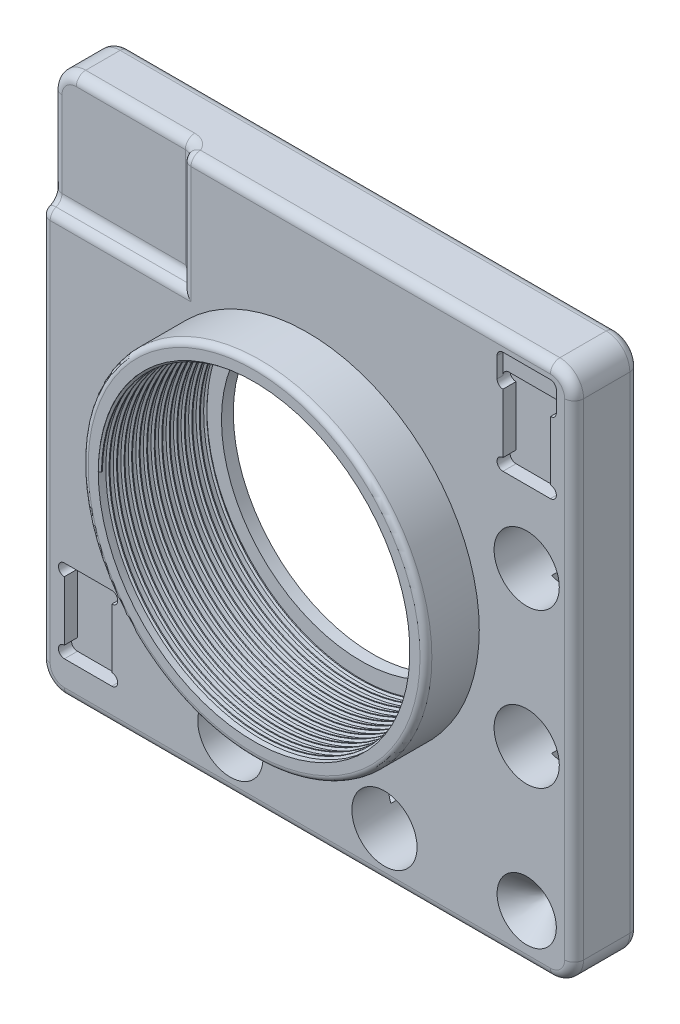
SolidWorks part; units mm, degrees
ref_plane "前视基准面" through (0, 0, 0) normal (0, 0, 1) x (1, 0, 0)
ref_plane "上视基准面" through (0, 0, 0) normal (0, 1, 0) x (1, 0, 0)
ref_plane "右视基准面" through (0, 0, 0) normal (1, 0, 0) x (0, 0, -1)
other "Configuration Table"
sketch "草图1" plane through (0, 0, 0) normal (0, 0, 1) x (1, 0, 0)
  line L1 (-22.5, 22.5) -> (22.5, 22.5)
  line L2 (-22.5, 22.5) -> (-22.5, -22.5)
  line L3 (-22.5, -22.5) -> (22.5, -22.5)
  line L4 (22.5, 22.5) -> (22.5, -22.5)
  line L5 (-22.5, 22.5) -> (22.5, -22.5) construction
  line L6 (-22.5, -22.5) -> (22.5, 22.5) construction
  point P0 (0, 0)
  dimension "D1" = 45
  dimension "D2" = 45
extrude "凸台-拉伸1" add sketch "草图1" along normal blind 5.5
sketch "草图2" plane through (0, 0, 0) normal (0, 0, -1) x (-1, 0, 0)
  line L0 (22.5, -22.5) -> (-22.5, -22.5) construction
  line L1 (0, 22.5) -> (0, -23.8511) construction
  line L2 (-22.5, 22.5) -> (22.5, 22.5) construction
  circle A0 centre (0, 0) radius 11.75
  dimension "D2" = 23.5
  dimension "D1" = 22.5
extrude "切除-拉伸1" cut sketch "草图2" against normal up to next
sketch "草图3" plane through (0, 0, 5.5) normal (0, 0, 1) x (1, 0, 0)
  circle A0 centre (0, 0) radius 11.75 construction
  circle A1 centre (0, 0) radius 11.75
  circle A2 centre (0, 0) radius 14.5
  dimension "D1" = 29
extrude "凸台-拉伸2" add sketch "草图3" along normal blind 4.5
sketch "草图10" plane through (0, 0, 10) normal (0, 0, 1) x (1, 0, 0)
  circle A0 centre (0, 0) radius 13.1445
  dimension "D1" = 26.289
extrude "切除-拉伸2" cut sketch "草图10" against normal offset from surface (9 mm away) 1
thread "螺纹线1" pitch 0.3175 start angle 0, offset 0, length 0, pitch 0.635, diameter 26.289
ref_plane "基准面5" through (-13.1445, 0, 10) normal (0, -1, 0) x (-1, 0, 0)
sketch "螺纹线轮廓5" plane through (-13.1445, 0, 10) normal (0, -1, 0) x (-1, 0, 0)
  line L0 (0, 0) -> (0, 0.3175) construction
  line L11 (0, 0) -> (0, 0.2778)
  line L12 (0, 0.2778) -> (-0.1719, 0.1786)
  line L13 (-0.1719, 0.1786) -> (-0.1719, 0.0992)
  line L15 (-0.1719, 0.0992) -> (0, 0)
  line L17 (-0.1719, 0.1389) -> (0, 0.1389) construction
  point P2 (0, 0)
  dimension "Pitch" = 0.3175
  dimension "Profile_Angle" = 60
  dimension "Profile_Land" = 0.0794
  dimension "Profile_Height" = 0.1719
hole_wizard "Ø5.5 (5.5) 直径孔1" positions "草图15" profile "草图16" hole size "Ø5.5" standard "GB"
sketch "草图15" plane through (0, 0, 5.5) normal (0, 0, 1) x (1, 0, 0)
  line L0 (22.5, -22.5) -> (22.5, 22.5) construction
  line L1 (-22.5, -22.5) -> (22.5, -22.5) construction
  point P0 (18.5, 6.5)
  point P2 (18.5, -6.5)
  point P4 (6.5, -18.5)
  point P6 (-6.5, -18.5)
  dimension "D1" = 4
  dimension "D2" = 4
  dimension "D3" = 4
  dimension "D4" = 4
  dimension "D5" = 13
  dimension "D6" = 13
  dimension "D7" = 16
  dimension "D8" = 16
sketch "草图16" plane through (18.5, 6.5, 5.5) normal (1, 0, 0) x (0, -1, 0)
  line L0 (0, 0) -> (0, 5.5)
  line L1 (0, 5.5) -> (2.75, 5.5)
  line L2 (2.75, 5.5) -> (2.75, 0)
  line L5 (2.75, 0) -> (0, 0)
  line L11 (0, -6.35) -> (0, 107.95) construction
  dimension "通孔孔直径" = 5.5
  dimension "通孔孔深度" = 5.5
ref_plane "基准面6" through (18.5, 0, 0) normal (1, 0, 0) x (0, 0, -1)
sketch "草图18" plane through (18.5, 0, 0) normal (1, 0, 0) x (0, 0, -1)
  line L0 (-5.5, -18.5) -> (-3, -18.5)
  line L1 (-5.5, -22.5) -> (-5.5, 22.5) construction
  line L2 (-3, -18.5) -> (-5.5, -16)
  line L3 (-5.5, -16) -> (-5.5, -18.5)
  line L4 (-5.5, -22.5) -> (0, -22.5) construction
  dimension "D1" = 2.5
  dimension "D2" = 2.5
  dimension "D3" = 4
revolve "切除-旋转1" cut sketch "草图18" angle 360 about L0
sketch "草图19" plane through (0, 0, 5.5) normal (0, 0, 1) x (1, 0, 0)
  line L0 (-20.5, -13.1) -> (-16.5, -13.1) construction
  line L1 (-20.5, -12.6) -> (-16.5, -12.6)
  line L3 (-20.5, -19.1) -> (-16.5, -19.1) construction
  line L5 (-20.5, -19.6) -> (-16.5, -19.6)
  line L6 (-20.5, -13.6) -> (-20.5, -18.6)
  line L7 (-16.5, -18.6) -> (-16.5, -13.6)
  line L8 (-18.5, -12.6) -> (-18.5, -19.6) construction
  line L9 (-22.5, 22.5) -> (-22.5, -22.5) construction
  line L10 (-22.5, -22.5) -> (22.5, -22.5) construction
  line L11 (16.5, 19.1) -> (20.5, 19.1) construction
  line L12 (16.5, 19.6) -> (20.5, 19.6)
  line L13 (16.5, 13.1) -> (20.5, 13.1) construction
  line L14 (16.5, 12.6) -> (20.5, 12.6)
  line L15 (16.5, 18.6) -> (16.5, 13.6)
  line L16 (20.5, 13.6) -> (20.5, 18.6)
  line L17 (18.5, 19.6) -> (18.5, 12.6) construction
  line L18 (22.5, 22.5) -> (-22.5, 22.5) construction
  line L19 (22.5, -22.5) -> (22.5, 22.5) construction
  arc A0 (-20.5, -12.6) -> (-20.5, -13.6) centre (-20.5, -13.1) ccw
  arc A1 (-16.5, -13.6) -> (-16.5, -12.6) centre (-16.5, -13.1) ccw
  arc A2 (-20.5, -18.6) -> (-20.5, -19.6) centre (-20.5, -19.1) ccw
  arc A3 (-16.5, -19.6) -> (-16.5, -18.6) centre (-16.5, -19.1) ccw
  arc A4 (16.5, 19.6) -> (16.5, 18.6) centre (16.5, 19.1) ccw
  arc A5 (20.5, 18.6) -> (20.5, 19.6) centre (20.5, 19.1) ccw
  arc A6 (16.5, 13.6) -> (16.5, 12.6) centre (16.5, 13.1) ccw
  arc A7 (20.5, 12.6) -> (20.5, 13.6) centre (20.5, 13.1) ccw
  point P2 (-19, -13)
  point P7 (-19, -19)
  point P26 (15.0762, 17.4727)
  point P31 (15.0762, 11.4727)
  dimension "D3" = 0.5
  dimension "D6" = 0.5
  dimension "D7" = 0.5
  dimension "D8" = 0.5
  dimension "D1" = 4
  dimension "D2" = 7
  dimension "D4" = 2
  dimension "D5" = 2.9
  dimension "D9" = 2.9
  dimension "D10" = 2
  dimension "D11" = 4
  dimension "D12" = 7
extrude "切除-拉伸3" cut sketch "草图19" against normal blind 1.1
sketch "草图20" plane through (0, 0, 5.5) normal (0, 0, 1) x (1, 0, 0)
  line L0 (16, 19.1) -> (16, 20.8)
  line L1 (16.5, 21.3) -> (20.5, 21.3)
  line L2 (21, 20.8) -> (21, 19.1)
  line L3 (20.5, 19.6) -> (16.5, 19.6) construction
  line L4 (20.5, 19.6) -> (16.5, 19.6)
  arc A0 (20.5, 18.6) -> (20.5, 19.6) centre (20.5, 19.1) ccw construction
  arc A1 (16.5, 19.6) -> (16.5, 18.6) centre (16.5, 19.1) ccw construction
  arc A2 (21, 19.1) -> (20.5, 19.6) centre (20.5, 19.1) ccw
  arc A3 (16.5, 19.6) -> (16, 19.1) centre (16.5, 19.1) ccw
  arc A4 (21, 20.8) -> (20.5, 21.3) centre (20.5, 20.8) ccw
  arc A5 (16.5, 21.3) -> (16, 20.8) centre (16.5, 20.8) ccw
  dimension "D2" = 0.5
  dimension "D1" = 2.7
extrude "切除-拉伸4" cut sketch "草图20" against normal blind 0.5 contours L1 A4 L2 A2 L4 A3 L0 A5
sketch "草图21" plane through (0, 0, 0) normal (0, 0, -1) x (-1, 0, 0)
  line L0 (-18.5, 9.25) -> (-18.5, -9.25) construction
  line L1 (9.25, -18.5) -> (-9.25, -18.5) construction
  line L2 (-18.5, 10) -> (-18.5, -10) construction
  line L3 (-17.5, 10) -> (-17.5, -10)
  line L4 (-19.5, 10) -> (-19.5, -10)
  line L5 (-10, -18.5) -> (10, -18.5) construction
  line L6 (-10, -17.5) -> (10, -17.5)
  line L12 (-10, -19.5) -> (10, -19.5)
  circle A1 centre (-18.5, 6.5) radius 2.75 construction
  circle A17 centre (-18.5, -6.5) radius 2.75 construction
  circle A18 centre (6.5, -18.5) radius 2.75 construction
  circle A19 centre (-6.5, -18.5) radius 2.75 construction
  arc A20 (-17.5, 10) -> (-19.5, 10) centre (-18.5, 10) ccw
  arc A21 (-19.5, -10) -> (-17.5, -10) centre (-18.5, -10) ccw
  arc A22 (-10, -17.5) -> (-10, -19.5) centre (-10, -18.5) ccw
  arc A23 (10, -19.5) -> (10, -17.5) centre (10, -18.5) ccw
  point P15 (-18.5, 0)
  point P22 (0, -18.5)
  dimension "D1" = 2
  dimension "D2" = 20
  dimension "D3" = 20
  dimension "D4" = 2
extrude "切除-拉伸5" cut sketch "草图21" against normal blind 2.4
sketch "草图22" plane through (0, 0, 5.5) normal (0, 0, 1) x (1, 0, 0)
  line L0 (-22.5, 12.5) -> (-10.5, 12.5)
  line L1 (-22.5, 22.5) -> (-22.5, -22.5) construction
  line L2 (-10.5, 12.5) -> (-10.5, 22.5)
  line L3 (22.5, 22.5) -> (-22.5, 22.5) construction
  line L4 (-10.5, 22.5) -> (-22.5, 22.5)
  line L5 (-22.5, 22.5) -> (-22.5, 12.5)
  dimension "D1" = 12
  dimension "D2" = 10
extrude "切除-拉伸6" cut sketch "草图22" against normal blind 1
fillet "圆角1" radius 2 4 edges at (22.5, 22.5, 2.75) (22.5, -22.5, 2.75) (-22.5, -22.5, 2.75) (-22.5, 22.5, 2.25)
fillet "圆角3" radius 0.8 2 edges at (-16.5, 12.5, 4.5) (-10.5, 17.5, 4.5)
fillet "圆角5" radius 0.8 20 edges at (-21.9142, 21.9142, 0) (0, 22.5, 0) (21.9142, 21.9142, 0) (22.5, 0, 0) (21.9142, -21.9142, 0) (0, -22.5, 0) (-21.9142, -21.9142, 0) (5, 22.5, 5.5) (21.9142, 21.9142, 5.5) (22.5, 0, 5.5) (21.9142, -21.9142, 5.5) (0, -22.5, 5.5) (-21.9142, -21.9142, 5.5) (-22.5, 0, 0) (-22.5, -4, 5.5) (-10.7343, 22.5, 4.7343) (-15.9, 22.5, 4.5) (-21.9142, 21.9142, 4.5) (-22.5, 16.9, 4.5) (-22.5, 12.7343, 4.7343)
fillet "圆角6" radius 0.5 1 edges at (14.5, 0, 10)
fillet "圆角7" radius 0.8 4 edges at (-22.4264, 12.0633, 5.0353) (-10.0633, 22.4264, 5.0353) (-16.1, 12.5, 5.5) (-10.5, 17.1, 5.5)
chamfer "倒角1" distance 0.3 angle 45 24 edges at (-9.5309, -19.5, 0) (-9.5309, -17.5, 0) (-11, -18.5, 0) (-6.5, -21.25, 0) (-6.5, -15.75, 0) (0, -19.5, 0) (0, -17.5, 0) (6.5, -15.75, 0) (9.5309, -17.5, 0) (6.5, -21.25, 0) (9.5309, -19.5, 0) (11, -18.5, 0) (17.5, -9.5309, 0) (18.5, -11, 0) (19.5, -9.5309, 0) (15.75, -6.5, 0) (21.25, -6.5, 0) (17.5, 0, 0) (15.75, 6.5, 0) (17.5, 9.5309, 0) (18.5, 11, 0) (19.5, 9.5309, 0) (21.25, 6.5, 0) (19.5, 0, 0)
